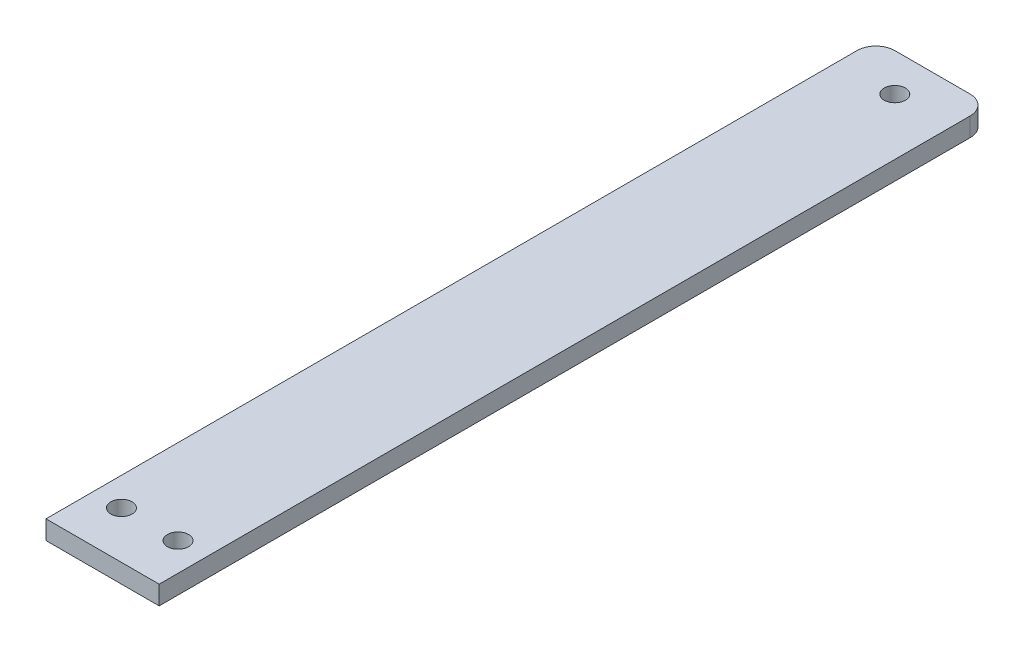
SolidWorks part; units mm, degrees
ref_plane "Front Plane" through (0, 0, 0) normal (0, 0, 1) x (1, 0, 0)
ref_plane "Top Plane" through (0, 0, 0) normal (0, 1, 0) x (1, 0, 0)
ref_plane "Right Plane" through (0, 0, 0) normal (1, 0, 0) x (0, 0, -1)
sketch "Sketch1" plane through (0, 0, 0) normal (0, 1, 0) x (1, 0, 0)
  line L1 (-19.05, -139.7) -> (19.05, -139.7)
  line L2 (-19.05, -139.7) -> (-19.05, 139.7)
  line L3 (-19.05, 139.7) -> (19.05, 139.7)
  line L4 (19.05, -139.7) -> (19.05, 139.7)
  line L5 (-19.05, -139.7) -> (19.05, 139.7) construction
  line L6 (-19.05, 139.7) -> (19.05, -139.7) construction
  circle A0 centre (0, 127) radius 3.5719
  circle A1 centre (-9.525, -123.825) radius 3.5719
  circle A2 centre (9.525, -123.825) radius 3.5719
  point P0 (0, 0)
  point P9 (0, 139.7)
  point P15 (0, 0)
  dimension "D1" = 7.1437
  dimension "D5" = 7.1437
  dimension "D6" = 7.1437
  dimension "D7" = 15.875
  dimension "D9" = 9.525
  dimension "D2" = 38.1
  dimension "D3" = 279.4
  dimension "D4" = 12.7
  dimension "D8" = 9.525
extrude "Boss-Extrude1" add sketch "Sketch1" along normal blind 6.35
fillet "Fillet1" radius 6.35 2 edges at (-19.05, 3.175, -139.7) (19.05, 3.175, -139.7)
